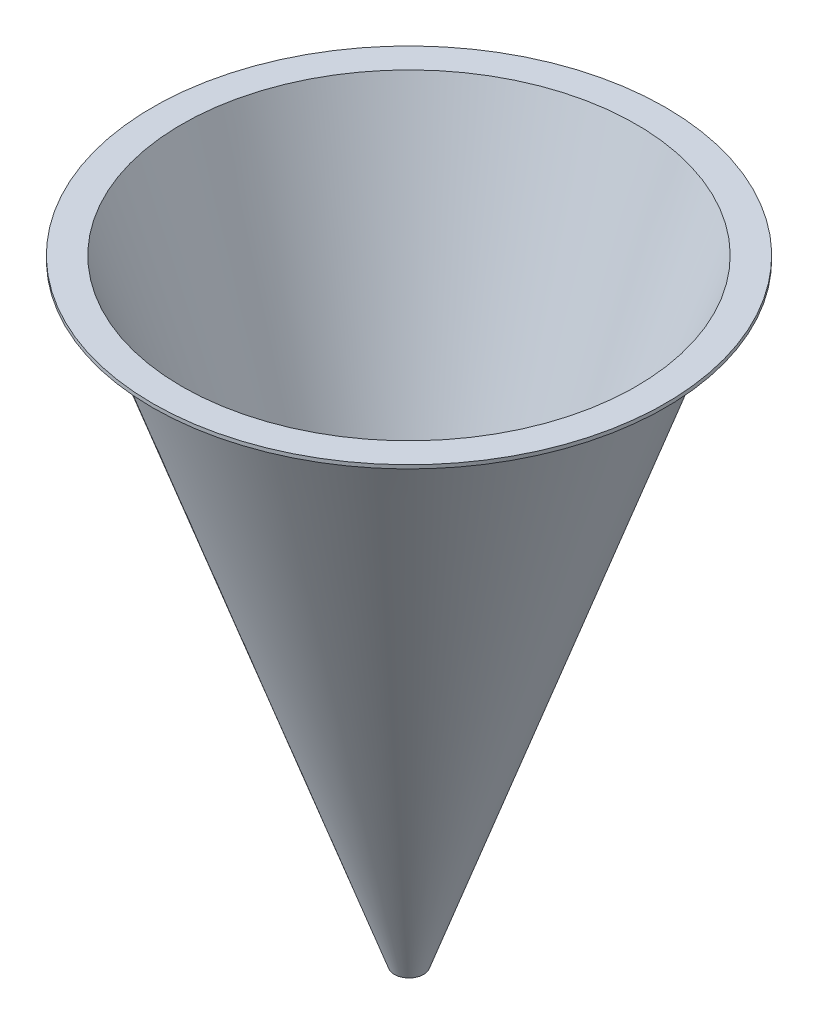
SolidWorks part; units mm, degrees
ref_plane "Plane1" through (0, 0, 0) normal (0, 0, 1) x (1, 0, 0)
ref_plane "Plane2" through (0, 0, 0) normal (0, 1, 0) x (1, 0, 0)
ref_plane "Plane3" through (0, 0, 0) normal (1, 0, 0) x (0, 0, -1)
sketch "Sketch2" plane through (0, 0, 0) normal (0, 0, 1) x (1, 0, 0)
  line L0 (444.5, 0) -> (393.7, 0)
  line L1 (393.7, 0) -> (18.9935, -1066.8)
  line L2 (18.9935, -1066.8) -> (25.4, -1066.8)
  line L3 (25.4, -1066.8) -> (400.05, -6.35)
  line L4 (400.05, -6.35) -> (444.5, -6.35)
  line L5 (444.5, -6.35) -> (444.5, 0)
  line L6 (0, 69.3999) -> (0, -1153.1471) construction
  dimension "D1" = 50.8
  dimension "D2" = 44.45
  dimension "D3" = 400.05
  dimension "D4" = 25.4
  dimension "D5" = 1066.8
  dimension "D6" = 6.4065
  dimension "D7" = 6.35
revolve "Base-Revolve" add sketch "Sketch2" angle 360 about L6
